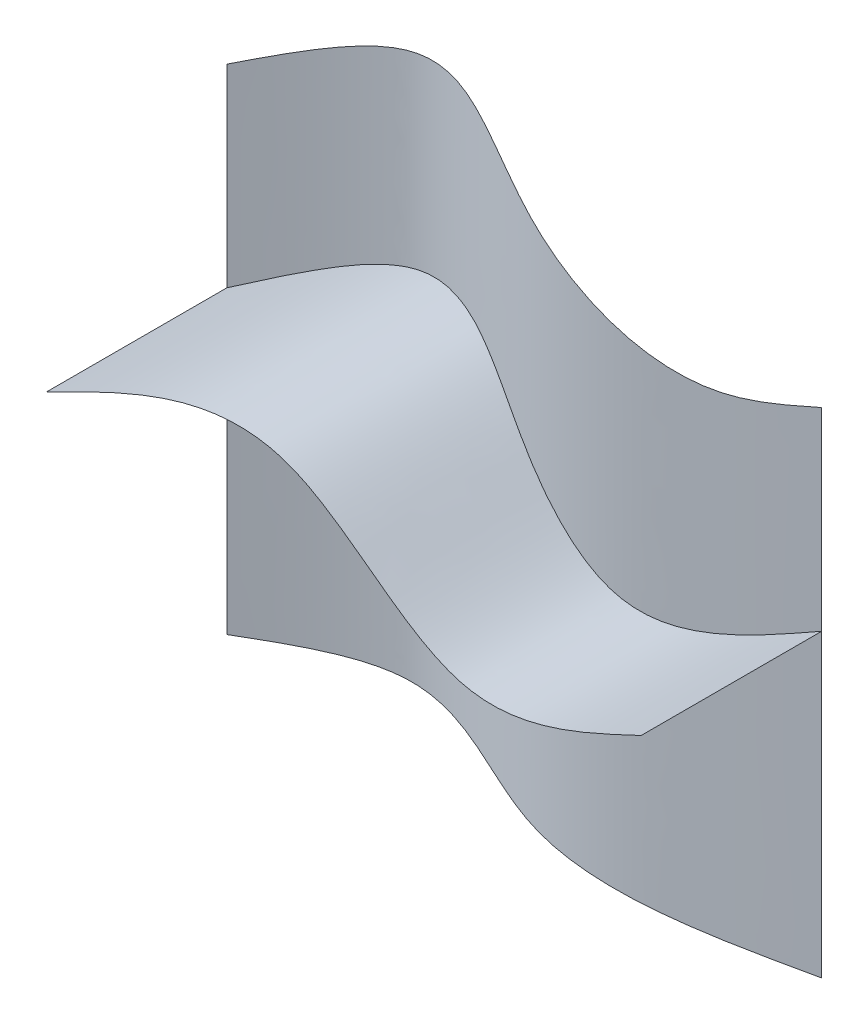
SolidWorks part; units mm, degrees
ref_plane "Front" through (0, 0, 0) normal (0, 0, 1) x (1, 0, 0)
ref_plane "Top" through (0, 0, 0) normal (0, 1, 0) x (1, 0, 0)
ref_plane "Right" through (0, 0, 0) normal (1, 0, 0) x (0, 0, -1)
sketch "Sketch1" plane through (0, 0, 0) normal (0, 0, 1) x (1, 0, 0)
  spline_without_curve S0
surface "Surface-Extrude1" sketch "Sketch1" parameters "D1"=101
sketch "Sketch2" plane through (0, 0, 0) normal (0, 1, 0) x (1, 0, 0)
  line L0 (-79.4813, -50.5) -> (-79.4813, 50.5) construction
  line L1 (86.9618, 50.5) -> (86.9618, -50.5) construction
  spline S0 degree 3 poles (-79.4813, 0) (-67.4715, 6.978) (-38.3484, 23.8994) (15.5717, -15.4523) (60.6203, -5.7016) (86.9618, 0) knots 0 0 0 0 0.22566 0.547216 1 1 1 1
surface "Surface-Extrude2" sketch "Sketch2" parameters "D1"=168.0366
sketch "Sketch3" plane through (0, 0, 0) normal (0, 0, 1) x (1, 0, 0)
  line L0 (-79.4813, 84.0183) -> (-79.4813, -84.0183) construction
  spline_without_curve S0
surface "Surface-Trim9"
sketch "Sketch4" plane through (0, 0, 0) normal (0, 1, 0) x (1, 0, 0)
  line L1 (1.5801, -14.851) -> (95.9667, -14.851)
  line L2 (1.5801, -14.851) -> (1.5801, -54.2735)
  line L3 (1.5801, -54.2735) -> (95.9667, -54.2735)
  line L4 (95.9667, -14.851) -> (95.9667, -54.2735)
surface "Surface-Trim10"
